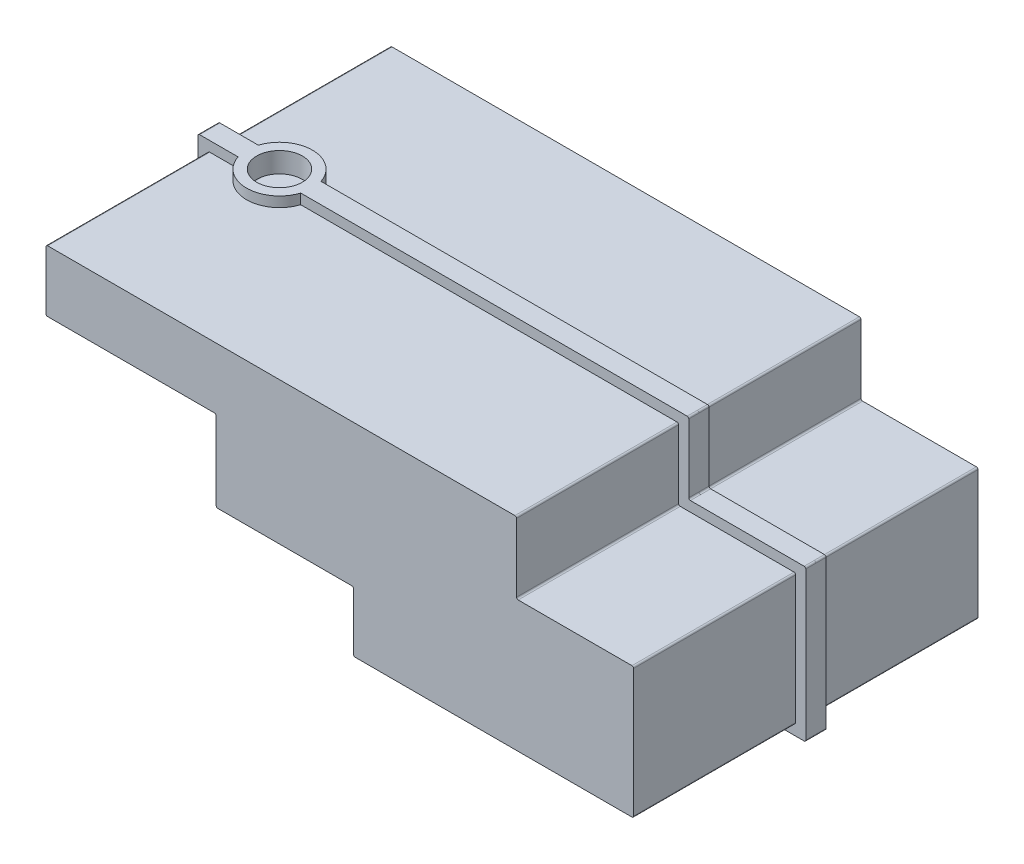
SolidWorks part; units mm, degrees
ref_plane "Front Plane" through (0, 0, 0) normal (0, 0, 1) x (1, 0, 0)
ref_plane "Top Plane" through (0, 0, 0) normal (0, 1, 0) x (1, 0, 0)
ref_plane "Right Plane" through (0, 0, 0) normal (1, 0, 0) x (0, 0, -1)
sketch "Sketch1" plane through (0, 0, 0) normal (0, 0, 1) x (1, 0, 0)
  line L1 (-190.5, -69.85) -> (190.5, -69.85)
  line L2 (-190.5, -69.85) -> (-190.5, 69.85)
  line L3 (-190.5, 69.85) -> (190.5, 69.85)
  line L4 (190.5, -69.85) -> (190.5, 69.85)
  line L5 (-190.5, -69.85) -> (190.5, 69.85) construction
  line L6 (-190.5, 69.85) -> (190.5, -69.85) construction
  point P0 (0, 0)
  dimension "D1" = 381
  dimension "D2" = 139.7
extrude "Boss-Extrude1" add sketch "Sketch1" along normal blind 107.95
sketch "Sketch4" plane through (0, 69.85, 0) normal (0, 1, 0) x (1, 0, 0)
  line L0 (0, 73.1408) -> (0, -151.4479) construction
  line L3 (190.5, -107.95) -> (-190.5, -107.95) construction
  circle A3 centre (-145.7325, -107.95) radius 14.2875
  dimension "D1" = 28.575
sketch "Sketch5" plane through (0, -69.85, 0) normal (0, -1, 0) x (1, 0, 0)
  line L0 (0, 142.0014) -> (0, -55.2307) construction
  line L2 (-190.5, 107.95) -> (190.5, 107.95) construction
  circle A2 centre (129.286, 107.95) radius 14.2875
  dimension "D2" = 61.214
  dimension "D1" = 28.575
extrude "Cut-Extrude4" cut sketch "Sketch4" against normal blind 12.7 contours A3
extrude "Cut-Extrude5" cut sketch "Sketch5" against normal blind 12.7 contours A2
sketch "Sketch7" plane through (0, 0, 107.95) normal (0, 0, 1) x (1, 0, 0)
  line L1 (-25.0812, 91.8744) -> (-25.0812, -11.2784) construction
  line L6 (-145.7325, 88.5946) -> (-145.7325, 25.0169) construction
  line L22 (68.2625, 31.1165) -> (68.2625, -57.8461) construction
  line L48 (-173.6725, 57.15) -> (72.7075, 57.15)
  line L49 (-173.6725, 57.15) -> (-173.6725, 44.1057)
  line L50 (-173.6725, 44.1057) -> (-39.3687, 44.1057)
  line L51 (72.7075, 57.15) -> (72.7075, 44.1057)
  line L57 (-49.8475, 6.0057) -> (-39.3687, 6.0057)
  line L58 (-49.8475, 6.0057) -> (-49.8475, -6.6943)
  line L59 (-49.8475, -6.6943) -> (53.975, -6.6943)
  line L60 (141.9225, 6.0057) -> (141.9225, -6.6943)
  line L66 (129.286, -23.4511) -> (129.286, -92.077) construction
  line L67 (46.6725, -44.7943) -> (53.975, -44.7943)
  line L68 (46.6725, -44.7943) -> (46.6725, -57.4943)
  line L69 (46.6725, -57.4943) -> (173.6725, -57.4943)
  line L70 (173.6725, -44.7943) -> (173.6725, -57.4943)
  line L71 (-10.7937, 44.1057) -> (72.7075, 44.1057)
  line L72 (-10.7937, 6.0057) -> (141.9225, 6.0057)
  line L74 (-39.3687, 44.1057) -> (-39.3687, 6.0057)
  line L76 (-10.7937, 44.1057) -> (-10.7937, 6.0057)
  line L77 (82.55, -6.6943) -> (141.9225, -6.6943)
  line L78 (82.55, -44.7943) -> (173.6725, -44.7943)
  line L81 (53.975, -6.6943) -> (53.975, -44.7943)
  line L83 (82.55, -6.6943) -> (82.55, -44.7943)
  point P23 (-25.0812, 34.3031)
  dimension "D1" = 14.2875
  dimension "D2" = 246.38
extrude "Cut-Extrude9" cut sketch "Sketch7" against normal blind 95.25
sketch "Sketch9" plane through (0, 0, 107.95) normal (0, 0, 1) x (1, 0, 0)
  line L0 (2.2225, -69.85) -> (2.2225, -32.0943)
  line L1 (-190.5, -69.85) -> (114.9985, -69.85) construction
  line L2 (2.2225, -32.0943) -> (-83.8187, -32.0943)
  line L3 (-83.8187, -32.0943) -> (-83.8187, 18.7057)
  line L4 (-83.8187, 18.7057) -> (-190.5, 18.7057)
  line L5 (-190.5, 69.85) -> (-190.5, -69.85) construction
  line L6 (46.6725, -44.7943) -> (46.6725, -57.4943) construction
  line L7 (-49.8475, -6.6943) -> (53.975, -6.6943) construction
  line L8 (-39.3687, 44.1057) -> (-39.3687, 6.0057) construction
  line L9 (-173.6725, 44.1057) -> (-39.3687, 44.1057) construction
  line L10 (117.1575, 69.85) -> (117.1575, 25.0557)
  line L11 (190.5, 69.85) -> (-131.445, 69.85) construction
  line L12 (117.1575, 25.0557) -> (190.5, 25.0557)
  line L13 (190.5, -69.85) -> (190.5, 69.85) construction
  line L14 (72.7075, 44.1057) -> (72.7075, 57.15) construction
  line L15 (141.9225, 6.0057) -> (-10.7937, 6.0057) construction
  line L16 (-190.5, 18.7057) -> (-190.5, -69.85)
  line L17 (-190.5, -69.85) -> (2.2225, -69.85)
  line L18 (190.5, 25.0557) -> (190.5, 69.85)
  line L19 (190.5, 69.85) -> (117.1575, 69.85)
  dimension "D1" = 44.45
  dimension "D2" = 25.4
  dimension "D3" = 44.45
  dimension "D4" = 25.4
  dimension "D5" = 44.45
  dimension "D6" = 19.05
extrude "Cut-Extrude10" cut sketch "Sketch9" against normal through all
sketch "Sketch10" plane through (0, -69.85, 0) normal (0, -1, 0) x (1, 0, 0)
  line L7 (2.2225, 101.6) -> (2.2225, 0)
  line L8 (2.2225, 0) -> (190.5, 0)
  line L9 (148.9223, 101.6) -> (190.5, 101.6)
  line L10 (2.2225, 101.6) -> (109.6497, 101.6)
  line L11 (148.9223, 101.6) -> (190.5, 101.6)
  line L12 (2.2225, 101.6) -> (109.6497, 101.6)
  line L13 (190.5, 0) -> (190.5, 101.6)
  arc A3 (109.6497, 101.6) -> (148.9223, 101.6) centre (129.286, 107.95) ccw
  arc A4 (109.6497, 101.6) -> (148.9223, 101.6) centre (129.286, 107.95) ccw
  dimension "D1" = 6.35
extrude "Cut-Extrude11" cut sketch "Sketch10" against normal blind 6.35
sketch "Sketch11" plane through (0, -32.0943, 0) normal (0, -1, 0) x (1, 0, 0)
  line L0 (-83.8187, 0) -> (-83.8187, 107.95) construction
  line L1 (-83.8187, 101.6) -> (2.2225, 101.6)
  line L2 (-83.8187, 101.6) -> (-83.8187, 0)
  line L3 (-83.8187, 0) -> (2.2225, 0)
  line L4 (2.2225, 101.6) -> (2.2225, 0)
extrude "Cut-Extrude12" cut sketch "Sketch11" against normal blind 6.35
sketch "Sketch12" plane through (0, 18.7057, 0) normal (0, -1, 0) x (1, 0, 0)
  line L1 (-83.8187, 101.6) -> (-190.5, 101.6)
  line L2 (-83.8187, 101.6) -> (-83.8187, 0)
  line L3 (-83.8187, 0) -> (-190.5, 0)
  line L4 (-190.5, 101.6) -> (-190.5, 0)
extrude "Cut-Extrude13" cut sketch "Sketch12" against normal blind 6.35
sketch "Sketch13" plane through (2.2225, 0, 0) normal (-1, 0, 0) x (0, 0, 1)
  line L1 (101.6, -63.5) -> (0, -63.5)
  line L2 (101.6, -63.5) -> (101.6, -25.7443)
  line L3 (101.6, -25.7443) -> (0, -25.7443)
  line L4 (0, -63.5) -> (0, -25.7443)
extrude "Cut-Extrude14" cut sketch "Sketch13" against normal blind 6.35
sketch "Sketch14" plane through (-83.8187, 0, 0) normal (-1, 0, 0) x (0, 0, 1)
  line L1 (101.6, -25.7443) -> (0, -25.7443)
  line L2 (101.6, -25.7443) -> (101.6, 25.0557)
  line L3 (101.6, 25.0557) -> (0, 25.0557)
  line L4 (0, -25.7443) -> (0, 25.0557)
extrude "Cut-Extrude15" cut sketch "Sketch14" against normal blind 6.35
sketch "Sketch15" plane through (-190.5, 0, 0) normal (-1, 0, 0) x (0, 0, 1)
  line L1 (101.6, 25.0557) -> (0, 25.0557)
  line L2 (101.6, 25.0557) -> (101.6, 69.85)
  line L3 (101.6, 69.85) -> (0, 69.85)
  line L4 (0, 25.0557) -> (0, 69.85)
extrude "Cut-Extrude16" cut sketch "Sketch15" against normal blind 6.35
sketch "Sketch16" plane through (190.5, 0, 0) normal (1, 0, 0) x (0, 0, -1)
  line L1 (-101.6, -63.5) -> (0, -63.5)
  line L2 (-101.6, -63.5) -> (-101.6, 25.0557)
  line L3 (-101.6, 25.0557) -> (0, 25.0557)
  line L4 (0, -63.5) -> (0, 25.0557)
extrude "Cut-Extrude17" cut sketch "Sketch16" against normal blind 6.35
sketch "Sketch17" plane through (117.1575, 0, 0) normal (1, 0, 0) x (0, 0, -1)
  line L1 (-101.6, 25.0557) -> (0, 25.0557)
  line L2 (-101.6, 25.0557) -> (-101.6, 69.85)
  line L3 (-101.6, 69.85) -> (0, 69.85)
  line L4 (0, 25.0557) -> (0, 69.85)
extrude "Cut-Extrude18" cut sketch "Sketch17" against normal blind 6.35
sketch "Sketch18" plane through (0, 25.0557, 0) normal (0, 1, 0) x (1, 0, 0)
  line L1 (110.8075, 0) -> (184.15, 0)
  line L2 (110.8075, 0) -> (110.8075, -101.6)
  line L3 (110.8075, -101.6) -> (184.15, -101.6)
  line L4 (184.15, 0) -> (184.15, -101.6)
extrude "Cut-Extrude19" cut sketch "Sketch18" against normal blind 6.35
sketch "Sketch22" plane through (0, 69.85, 0) normal (0, 1, 0) x (1, 0, 0)
  line L4 (-184.15, -101.6) -> (-184.15, 0)
  line L5 (-184.15, 0) -> (110.8075, 0)
  line L6 (-165.3688, -101.6) -> (-190.5, -101.6)
  line L7 (117.1575, -101.6) -> (-126.0962, -101.6)
  line L8 (-165.3688, -101.6) -> (-184.15, -101.6)
  line L9 (110.8075, -101.6) -> (-126.0962, -101.6)
  line L10 (110.8075, 0) -> (110.8075, -101.6)
  arc A2 (-126.0962, -101.6) -> (-165.3688, -101.6) centre (-145.7325, -107.95) ccw
  arc A3 (-126.0962, -101.6) -> (-165.3688, -101.6) centre (-145.7325, -107.95) ccw
  dimension "D1" = 6.35
extrude "Cut-Extrude22" cut sketch "Sketch22" against normal blind 6.35
fillet "Fillet1" radius 1.016 32 edges at (-77.4687, 25.0557, 50.8) (8.5725, -63.5, 50.8) (-184.15, 25.0557, 50.8) (-184.15, 63.5, 50.8) (8.5725, -25.7443, 50.8) (-77.4687, -25.7443, 50.8) (184.15, -63.5, 50.8) (184.15, 18.7057, 50.8) (110.8075, 18.7057, 50.8) (110.8075, 63.5, 50.8) (173.6725, -44.7943, 60.325) (173.6725, -57.4943, 60.325) (141.9225, -6.6943, 60.325) (141.9225, 6.0057, 60.325) (46.6725, -44.7943, 60.325) (46.6725, -57.4943, 60.325) (-49.8475, 6.0057, 60.325) (-49.8475, -6.6943, 60.325) (72.7075, 57.15, 60.325) (72.7075, 44.1057, 60.325) (-173.6725, 57.15, 60.325) (-173.6725, 44.1057, 60.325) (2.2225, -32.0943, 104.775) (-83.8187, 18.7057, 104.775) (117.1575, 25.0557, 104.775) (-190.5, 69.85, 104.775) (-83.8187, -32.0943, 104.775) (-190.5, 18.7057, 104.775) (2.2225, -69.85, 104.775) (190.5, -69.85, 104.775) (190.5, 25.0557, 104.775) (117.1575, 69.85, 104.775)
ref_plane "Plane2" through (0, 0, 107.95) normal (0, 0, 1) x (1, 0, 0)
mirror "Mirror1" about plane through (0, 0, 107.95) normal (0, 0, 1) of "Cut-Extrude16", "Cut-Extrude18", "Cut-Extrude17", "Cut-Extrude13", "Cut-Extrude12", "Boss-Extrude1", "Cut-Extrude4", "Cut-Extrude5", "Cut-Extrude9", "Cut-Extrude10", "Cut-Extrude11", "Cut-Extrude14", "Cut-Extrude15", "Cut-Extrude19", "Cut-Extrude22", "Fillet1"
